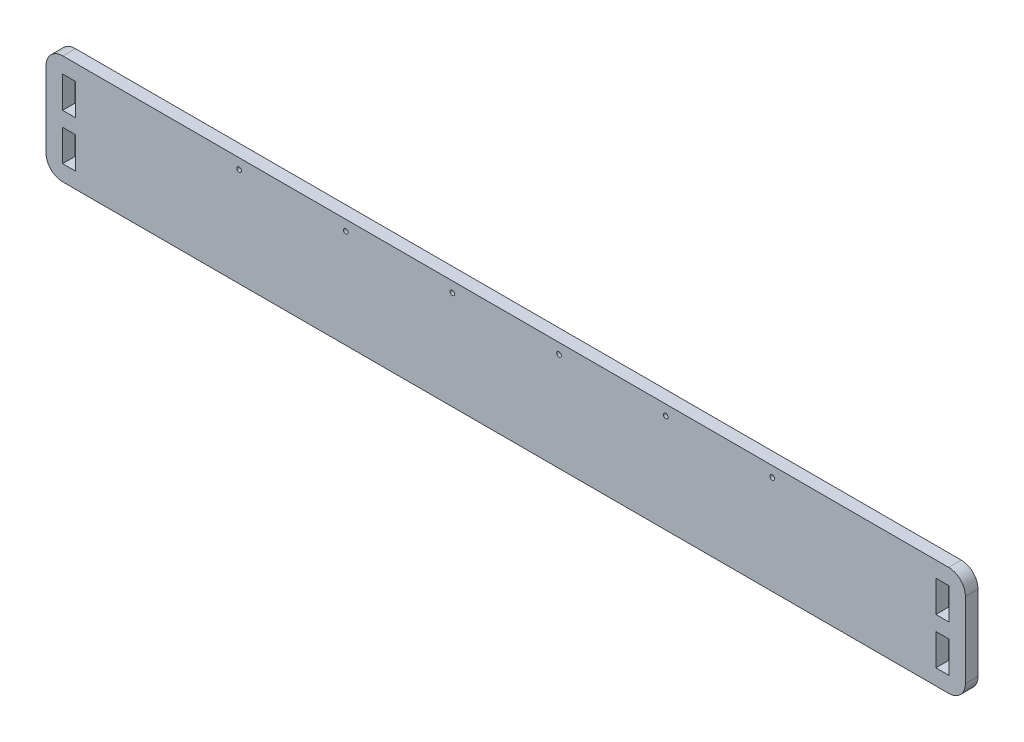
SolidWorks part; units mm, degrees
ref_plane "Front" through (0, 0, 0) normal (0, 0, 1) x (1, 0, 0)
ref_plane "Top" through (0, 0, 0) normal (0, 1, 0) x (1, 0, 0)
ref_plane "Right" through (0, 0, 0) normal (1, 0, 0) x (0, 0, -1)
sketch "Sketch1" plane through (0, 0, 0) normal (0, 0, 1) x (1, 0, 0)
  line L0 (-219, 72) -> (-219, 66) construction
  line L1 (-219, 60) -> (219, 60)
  line L2 (-219, 60) -> (-219, 8)
  line L3 (-219, 8) -> (219, 8)
  line L4 (219, 60) -> (219, 8)
  line L5 (219, 72) -> (219, 66) construction
  line L6 (221, 8) -> (-221, 8) construction
  line L7 (183.7325, 66) -> (218.9372, 66) construction
  line L8 (215, 66) -> (-176, 66) construction
  dimension "D1" = 6
extrude "Boss-Extrude1" add sketch "Sketch1" along normal blind 6
sketch "Sketch2" plane through (0, 0, 6) normal (0, 0, 1) x (1, 0, 0)
  line L0 (-219, 60) -> (-219, 8) construction
  line L1 (-219, 8) -> (219, 8) construction
  line L2 (0, 8) -> (0, 60) construction
  line L3 (219, 60) -> (-219, 60) construction
  line B0 (-204.9, 37.5) -> (-204.9, 52.5)
  line B1 (-204.9, 52.5) -> (-211.1, 52.5)
  line B2 (-211.1, 52.5) -> (-211.1, 37.5)
  line B3 (-211.1, 37.5) -> (-204.9, 37.5)
  line B4 (-208, 37.5) -> (-208, 52.5) construction
  line B5 (-211.1, 45) -> (-204.9, 45) construction
  line B6 (-204.9, 15.5) -> (-204.9, 30.5)
  line B7 (-204.9, 30.5) -> (-211.1, 30.5)
  line B8 (-211.1, 30.5) -> (-211.1, 15.5)
  line B9 (-211.1, 15.5) -> (-204.9, 15.5)
  line B10 (-208, 15.5) -> (-208, 30.5) construction
  line B11 (-211.1, 23) -> (-204.9, 23) construction
  line B12 (204.9, 15.5) -> (204.9, 30.5)
  line B13 (204.9, 30.5) -> (211.1, 30.5)
  line B14 (211.1, 30.5) -> (211.1, 15.5)
  line B15 (211.1, 15.5) -> (204.9, 15.5)
  line B16 (204.9, 37.5) -> (204.9, 52.5)
  line B17 (204.9, 52.5) -> (211.1, 52.5)
  line B18 (211.1, 52.5) -> (211.1, 37.5)
  line B19 (211.1, 37.5) -> (204.9, 37.5)
  dimension "D1" = 11
  dimension "D2" = 22
  dimension "D3" = 15
sketch_block_instance "Block-laser-cut-slot-15x6-1"
sketch_block "Block-laser-cut-slot-15x6" parameters "D1"=15, "D2"=6.2
sketch_block_instance "Block-laser-cut-slot-15x6-2"
sketch_block_instance "Block-laser-cut-slot-15x6-4"
sketch_block_instance "Block-laser-cut-slot-15x6-5"
extrude "holes for side panel tabs" cut sketch "Sketch2" against normal through all
fillet "Fillet1" radius 8 4 edges at (219, 60, 3) (219, 8, 3) (-219, 8, 3) (-219, 60, 3)
sketch "Sketch3" plane through (0, 0, 0) normal (0, 0, -1) x (-1, 0, 0)
  circle A0 centre (127, 55.0628) radius 2.3564 construction
  circle A1 centre (76.2, 55.0628) radius 2.3564 construction
  circle A2 centre (-25.4, 55.0628) radius 2.3564 construction
  circle A3 centre (-76.2, 55.0628) radius 2.3564 construction
  circle A4 centre (-127, 55.0628) radius 2.3564 construction
  circle A5 centre (127, 55.0628) radius 2.3564 construction
  circle A6 centre (76.2, 55.0628) radius 2.3564 construction
  circle A7 centre (-25.4, 55.0628) radius 2.3564 construction
  circle A8 centre (-76.2, 55.0628) radius 2.3564 construction
  circle A9 centre (-127, 55.0628) radius 2.3564 construction
  circle A10 centre (25.4, 55.0628) radius 2.3564 construction
  circle A11 centre (25.4, 55.0628) radius 2.3564 construction
  circle A12 centre (-127, 55.0628) radius 1.1
  circle A13 centre (-76.2, 55.0628) radius 1.1
  circle A14 centre (-25.4, 55.0628) radius 1.1
  circle A15 centre (25.4, 55.0628) radius 1.1
  circle A16 centre (76.2, 55.0628) radius 1.1
  circle A17 centre (127, 55.0628) radius 1.1
  dimension "D1" = 2.2
extrude "hinge screw pilot hole" cut sketch "Sketch3" against normal through all
